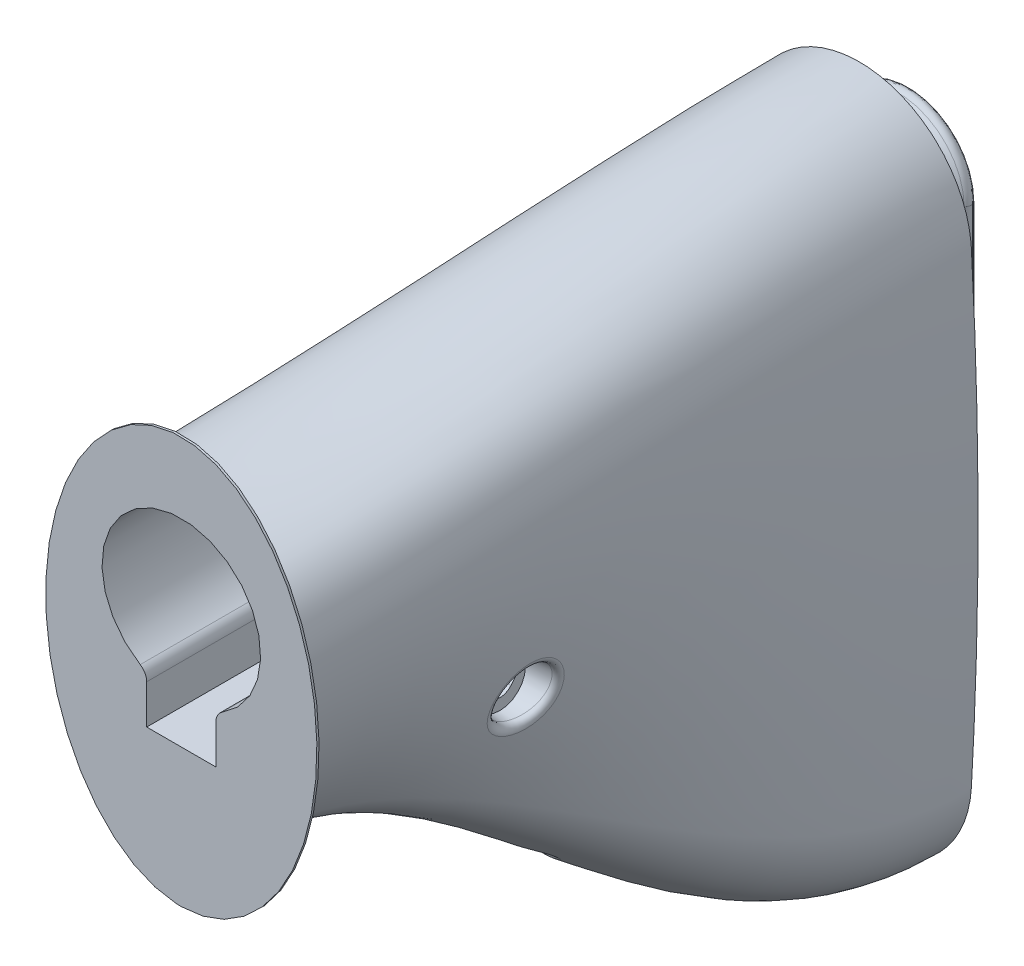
SolidWorks part; units mm, degrees
ref_plane "Front Plane" through (0, 0, 0) normal (0, 0, 1) x (1, 0, 0)
ref_plane "Top Plane" through (0, 0, 0) normal (0, 1, 0) x (1, 0, 0)
ref_plane "Right Plane" through (0, 0, 0) normal (1, 0, 0) x (0, 0, -1)
sketch "Sketch1" plane through (0, 0, 0) normal (0, 0, 1) x (1, 0, 0)
  line L0 (0, 37.2523) -> (0, -28.9777) construction
  line L1 (-22.225, 1.7278) -> (-22.225, 17.909) construction
  arc A0 (-14.2875, 13.501) -> (14.2875, 13.501) centre (0, -21.8186) cw
  arc A1 (-14.2875, 13.501) -> (-22.225, 1.7278) centre (-9.525, 1.7278) ccw
  arc A2 (14.2875, 13.501) -> (22.225, 1.7278) centre (9.525, 1.7278) cw
  arc A3 (-9.9123, -33.3395) -> (9.9123, -33.3395) centre (0, -25.4) ccw
  arc A4 (-22.225, 1.7278) -> (-9.9123, -33.3395) centre (33.8684, 1.7278) ccw
  arc A5 (22.225, 1.7278) -> (9.9123, -33.3395) centre (-33.8684, 1.7278) cw
  dimension "D1" = 12.7
  dimension "D2" = 38.1
  dimension "D3" = 25.4
  dimension "D4" = 44.45
  dimension "D5" = 21.8186
ref_plane "Plane1" through (0, 0, -127) normal (0, 0, -1) x (-1, 0, 0)
sketch "Sketch2" plane through (0, 0, -127) normal (0, 0, -1) x (-1, 0, 0)
  line L0 (0, 200037.2523) -> (0, -200028.9777) construction
  line L1 (0, 25.4) -> (0, -101.6) construction
  line L2 (-22.225, -38.1) -> (22.225, -38.1) construction
  line L3 (-20.9709, 5.5991) -> (-20.9709, -81.7991) construction
  arc A6 (20.9709, 5.5991) -> (14.2875, 19.7925) centre (0, 4.3945) ccw
  arc A7 (20.9709, -81.7991) -> (20.9709, 5.5991) centre (-739.775, -38.1) ccw
  arc A8 (-20.9709, -81.7991) -> (20.9709, -81.7991) centre (0, -80.5945) ccw
  arc A9 (-20.9709, 5.5991) -> (-20.9709, -81.7991) centre (739.775, -38.1) ccw
  arc A10 (-14.2875, 19.7925) -> (-20.9709, 5.5991) centre (0, 4.3945) ccw
  arc A11 (14.2875, 19.7925) -> (-14.2875, 19.7925) centre (0, 4.3945) ccw
  dimension "D1" = 25.4
  dimension "D2" = 762
  dimension "D4" = 127
  dimension "D5" = 44.45
loft "Loft1" add profiles "Sketch1", "Sketch2"
sketch "Sketch3" plane through (0, 0, 0) normal (0, 0, 1) x (1, 0, 0)
  line L0 (-6.477, -13.373) -> (-6.477, -22.225)
  line L1 (-6.477, -22.225) -> (6.477, -22.225)
  line L2 (6.477, -22.225) -> (6.477, -13.373)
  line L3 (0, -22.225) -> (0, 0) construction
  arc A0 (6.477, -13.373) -> (-6.477, -13.373) centre (0, 0) ccw
  point P11 (0, 14.859)
  dimension "D2" = 14.859
  dimension "D3" = 12.954
  dimension "D4" = 37.084
extrude "Cut-Extrude1" cut sketch "Sketch3" against normal blind 91.44
sketch "Sketch4" plane through (0, 0, 0) normal (1, 0, 0) x (0, 0, -1)
  line L1 (91.44, -22.225) -> (0, -22.225) construction
  circle A0 centre (45.72, -22.225) radius 25.4
  dimension "D1" = 50.8
extrude "Cut-Extrude2" cut sketch "Sketch4" against normal mid plane 2.54
sketch "Sketch5" plane through (0, 0, 0) normal (1, 0, 0) x (0, 0, -1)
  line L0 (91.44, -22.225) -> (0, -22.225) construction
  line L1 (47.763, -25.7177) -> (48.895, -27.0667)
  line L2 (48.895, -27.0667) -> (48.895, -27.7973)
  line L3 (48.895, -27.7973) -> (47.763, -29.1463)
  line L4 (45.72, -27.432) -> (48.895, -27.432) construction
  arc A0 (47.763, -25.7177) -> (47.763, -29.1463) centre (45.72, -27.432) ccw
  circle A1 centre (45.72, -27.432) radius 2.667 construction
  circle A2 centre (45.72, -22.225) radius 25.4
  circle A3 centre (45.72, -22.225) radius 25.4 construction
  point P2 (45.72, -24.765)
  point P13 (48.387, -27.432)
  dimension "D1" = 5.334
  dimension "D4" = 0.508
  dimension "D2" = 2.54
  dimension "D5" = 100
  dimension "D3" = 0
extrude "Cut-Extrude3" cut sketch "Sketch5" against normal through all both and the other way through all
ref_plane "Plane2" through (13.97, 0, 0) normal (1, 0, 0) x (0, 0, -1)
ref_plane "Plane3" through (-13.97, 0, 0) normal (-1, 0, 0) x (0, 0, 1)
sketch "Sketch6" plane through (13.97, 0, 0) normal (1, 0, 0) x (0, 0, -1)
  circle A0 centre (45.72, -27.432) radius 4.7625
  dimension "D1" = 9.525
extrude "Cut-Extrude4" cut sketch "Sketch6" along normal through all draft 5
sketch "Sketch7" plane through (-13.97, 0, 0) normal (-1, 0, 0) x (0, 0, 1)
  line L1 (-51.2926, -27.432) -> (-48.5063, -32.258)
  line L2 (-48.5063, -32.258) -> (-42.9337, -32.258)
  line L3 (-42.9337, -32.258) -> (-40.1474, -27.432)
  line L4 (-40.1474, -27.432) -> (-42.9337, -22.606)
  line L5 (-42.9337, -22.606) -> (-48.5063, -22.606)
  line L6 (-48.5063, -22.606) -> (-51.2926, -27.432)
  circle A0 centre (-45.72, -27.432) radius 4.826 construction
  dimension "D1" = 9.652
extrude "Cut-Extrude5" cut sketch "Sketch7" along normal through all draft 5
sketch "Sketch8" plane through (0, 0, 0) normal (1, 0, 0) x (0, 0, -1)
  line L0 (91.44, 14.859) -> (0, 14.859)
  line L1 (91.44, 14.859) -> (0, 14.859) construction
  line L2 (0, 0) -> (91.44, 0) construction
  line L3 (91.44, 14.859) -> (106.299, 0)
  line L4 (106.299, 0) -> (91.44, 0)
  line L5 (91.44, 14.859) -> (91.44, 0)
  dimension "D1" = 45
revolve "Cut-Revolve1" cut sketch "Sketch8" angle 360 about L2
sketch "Sketch9" plane through (0, -22.225, 0) normal (0, 1, 0) x (1, 0, 0)
  line L0 (-6.477, 91.44) -> (6.477, 91.44)
  line L1 (6.477, 91.44) -> (0, 97.917)
  line L2 (0, 97.917) -> (-6.477, 91.44)
  dimension "D1" = 90
extrude "Cut-Extrude6" cut sketch "Sketch9" along normal up to next
fillet "Fillet1" radius 1.27 7 edges at (18.7831, -26.1096, -40.7079)
fillet "Fillet2" radius 1.27 2 edges at (1.27, -47.625, -45.72) (-1.27, -47.625, -45.72)
fillet "Fillet3" radius 1.27 6 edges at (0.898, -22.225, -70.748) (0.898, -22.225, -20.692) (-0.898, -22.225, -70.748) (-0.898, -22.225, -20.692) (-1.27, -22.225, -45.72) (1.27, -22.225, -45.72)
fillet "Fillet4" radius 2.54 3 edges at (6.477, -17.799, -91.44) (0, 14.859, -91.44) (-6.477, -17.799, -91.44)
fillet "Fillet5" radius 2.54 6 edges at (-6.477, -13.373, -45.1939) (-6.1935, -13.1942, -91.554) (6.1935, -13.1942, -91.554) (6.477, -13.373, -45.1939)
sketch "Sketch10" plane through (0, 0, -127) normal (0, 0, -1) x (-1, 0, 0)
  line L0 (0, 4.3945) -> (0, -80.5945) construction
  line L1 (12.7, 4.3945) -> (12.7, -80.5945)
  line L2 (-12.7, 4.3945) -> (-12.7, -80.5945)
  arc A0 (12.7, 4.3945) -> (-12.7, 4.3945) centre (0, 4.3945) ccw
  arc A1 (-12.7, -80.5945) -> (12.7, -80.5945) centre (0, -80.5945) ccw
  arc A4 (14.2875, 19.7925) -> (-14.2875, 19.7925) centre (0, 4.3945) ccw construction
  arc A5 (-20.9709, -81.7991) -> (20.9709, -81.7991) centre (0, -80.5945) ccw construction
  point P3 (0, -38.1)
  dimension "D1" = 25.4
extrude "Boss-Extrude1" add sketch "Sketch10" along normal blind 12.7
ref_plane "Plane4" through (0, -80.5945, 0) normal (0, -1, 0) x (-1, 0, 0)
sketch "Sketch11" plane through (0, -80.5945, 0) normal (0, -1, 0) x (-1, 0, 0)
  line L0 (-12.7, 139.7) -> (-12.7, 127) construction
  line L1 (-10.4549, 132.4201) -> (-12.328, 134.2932)
  line L2 (20.9709, 127) -> (-20.9709, 127) construction
  line L4 (-11.43, 136.4612) -> (0, 136.4612)
  line L5 (0, 136.4612) -> (0, 139.7)
  line L6 (0, 139.7) -> (-19.05, 139.7)
  line L7 (-19.05, 139.7) -> (-19.05, 127)
  line L8 (-19.05, 127) -> (-12.7, 127)
  line L9 (12.7, 139.7) -> (-12.7, 139.7) construction
  line L10 (-9.9504, 128.5875) -> (-10.8669, 127)
  line L11 (-12.7, 127) -> (-10.8669, 127)
  line L12 (12.7, 127) -> (-12.7, 127) construction
  arc A0 (-10.4549, 132.4201) -> (-9.9504, 128.5875) centre (-12.7, 130.175) cw
  arc A1 (-12.328, 134.2932) -> (-11.43, 136.4612) centre (-11.43, 135.1912) cw
  point P9 (-12.7, 133.35)
  dimension "D1" = 45
  dimension "D2" = 1.27
  dimension "D3" = 6.35
  dimension "D4" = 60
sketch "Sketch12" plane through (0, 0, -127) normal (0, 0, -1) x (-1, 0, 0)
  line L2 (12.7, -80.5945) -> (12.7, 4.3945)
  line L3 (-12.7, 4.3945) -> (-12.7, -80.5945)
  line L4 (12.7, -80.5945) -> (12.7, 4.3945)
  line L5 (-12.7, 4.3945) -> (-12.7, -80.5945)
  arc A2 (-12.7, -80.5945) -> (12.7, -80.5945) centre (0, -80.5945) ccw
  arc A3 (12.7, 4.3945) -> (-12.7, 4.3945) centre (0, 4.3945) ccw
  arc A4 (-12.7, -80.5945) -> (12.7, -80.5945) centre (0, -80.5945) ccw
  arc A5 (12.7, 4.3945) -> (-12.7, 4.3945) centre (0, 4.3945) ccw
  dimension "D1" = 0
sweep "Cut-Sweep1" cut profiles "Sketch11" path "Sketch12"
sketch "Sketch15" plane through (0, 0, -136.4612) normal (0, 0, -1) x (-1, 0, 0)
  line L0 (0, 4.3945) -> (0, -80.5945) construction
  line L1 (4.7625, 4.3945) -> (4.7625, -80.5945)
  line L2 (-4.7625, 4.3945) -> (-4.7625, -80.5945)
  arc A0 (4.7625, 4.3945) -> (-4.7625, 4.3945) centre (0, 4.3945) ccw
  arc A1 (-4.7625, -80.5945) -> (4.7625, -80.5945) centre (0, -80.5945) ccw
  arc A3 (11.43, 4.3945) -> (-11.43, 4.3945) centre (0, 4.3945) ccw construction
  arc A4 (-11.43, -80.5945) -> (11.43, -80.5945) centre (0, -80.5945) ccw construction
  point P3 (0, -38.1)
  dimension "D1" = 9.525
extrude "Cut-Extrude8" cut sketch "Sketch15" against normal blind 3.175
sketch "Sketch16" plane through (0, 0, 0) normal (1, 0, 0) x (0, 0, -1)
  line L0 (136.4612, -38.1) -> (127, -38.1)
  line L1 (136.4612, -80.5945) -> (136.4612, 4.3945) construction
  line L2 (85.0868, -87.0515) -> (40.1064, -51.2095) construction
  line L3 (62.5966, -69.1305) -> (91.4328, -32.9422) construction
  line L4 (127, -81.7991) -> (127, 5.5991) construction
  arc A0 (127, -38.1) -> (62.5966, -69.1305) centre (127, -120.4495) ccw
  spline S0 degree 3 poles (0, -38.1001) (0.2528, -38.1011) (0.7399, -38.1031) (1.4431, -38.1184) (2.0914, -38.1401) (2.6853, -38.1671) (3.7848, -38.2288) (5.0544, -38.3324) (6.2386, -38.4652) (6.8036, -38.5359) (7.7157, -38.6551) (9.2407, -38.8892) (11.3636, -39.2987) (13.4687, -39.7862) (16.2533, -40.5365) (19.6965, -41.6566) (23.7593, -43.2637) (27.7633, -45.1118) (31.7142, -47.1771) (35.6179, -49.4364) (39.4802, -51.8665) (43.3067, -54.444) (47.1032, -57.1459) (50.8753, -59.949) (54.6286, -62.8301) (58.3193, -65.7274) (62.6526, -69.1722) (67.0011, -72.6456) (71.413, -76.1238) (75.1849, -79.0381) (78.9517, -81.8629) (82.7416, -84.5923) (86.5601, -87.2031) (90.4129, -89.6722) (94.3057, -91.9763) (98.2443, -94.0924) (102.2344, -95.9969) (106.282, -97.6665) (110.3928, -99.0776) (113.8773, -100.0186) (116.6953, -100.6169) (118.8293, -100.9868) (120.959, -101.271) (122.6965, -101.434) (124.1485, -101.5279) (125.4544, -101.5872) (126.4447, -101.596) (127, -101.6009) knots 0 0 0 0 0.005235 0.010089 0.014566 0.018669 0.022401 0.037373 0.045045 0.047081 0.049165 0.064095 0.079027 0.093932 0.108838 0.138743 0.168862 0.199275 0.230033 0.261162 0.292663 0.324521 0.356702 0.389162 0.421847 0.454695 0.486338 0.536495 0.569959 0.602691 0.635213 0.667468 0.69941 0.731003 0.762225 0.793075 0.82357 0.853756 0.883706 0.913524 0.928441 0.943358 0.958368 0.97293 0.979491 0.988501 1 1 1 1 construction
  spline S1 degree 3 poles (-430.4883, -940.6885) (233.836, 1058.9492) (-106.8359, -1198.645) (557.4846, 800.9767) knots -1.531202 -1.531202 -1.531202 -1.531202 2.531195 2.531195 2.531195 2.531195 only from (0, -38.1) to (127, -101.6005)
  spline S2 degree 3 poles (662.9124, -834.4695) (235.6818, 943.1779) (-83.278, -901.4893) (-510.5078, 876.132) knots -3.175495 -3.175495 -3.175495 -3.175495 4.175469 4.175469 4.175469 4.175469 only from (152.4, 25.4003) to (0, 16.2814)
  spline S4 degree 3 poles (0, -38.1) (47.3302, -38.0999) (79.6698, -101.6006) (127, -101.6005) knots 0 0 0 0 1 1 1 1 construction
sketch "Sketch17" plane through (0, 0, -133.2862) normal (0, 0, -1) x (-1, 0, 0)
  line L0 (0, -38.1) -> (0, -69.1305) construction
  circle A0 centre (0, -38.1) radius 4.7625
  dimension "D1" = 9.525
sweep "Cut-Sweep2" cut profiles "Sketch17" path "Sketch16"
sketch "Sketch18" plane through (0, 0, 0) normal (1, 0, 0) x (0, 0, -1)
  line L0 (106.299, 0) -> (139.8698, 0) construction
  line L1 (110.3615, -39.7984) -> (159.0533, -29.7532) construction
  arc A0 (106.299, 0) -> (110.3615, -39.7984) centre (106.299, -20.1065) cw
  arc A1 (127, -38.1) -> (62.5966, -69.1305) centre (127, -120.4495) ccw construction
ref_plane "Plane5" through (0, 0, -106.299) normal (0, 0, 1) x (1, 0, 0)
sketch "Sketch19" plane through (0, 0, -106.299) normal (0, 0, 1) x (1, 0, 0)
  circle A0 centre (0, 0) radius 4.7625
  dimension "D1" = 9.525
sweep "Cut-Sweep3" cut profiles "Sketch19" path "Sketch18"
fillet "Fillet7" radius 1.27 2 edges at (4.7169, -69.1014, -63.4638) (-4.6765, -1.119, -101.4905)
fillet "Fillet8" radius 1.27 12 edges at (0, -85.357, -136.4612) (4.7625, -38.1, -136.4612) (0, 9.157, -136.4612) (0, -33.3375, -133.2862) (0, -42.8625, -133.2862) (-4.7625, -59.3472, -133.2862) (0, -85.357, -133.2862) (4.7625, -59.3472, -133.2862) (4.7625, -16.8528, -133.2862) (0, 9.157, -133.2862) (-4.7625, -38.1, -136.4612) (-4.7625, -16.8528, -133.2862)
sketch "Sketch13" plane through (0, 0, 0) normal (0, 0, 1) x (1, 0, 0)
  line L4 (-6.477, -13.373) -> (-6.477, -22.225)
  line L5 (-6.477, -22.225) -> (6.477, -22.225)
  line L6 (6.477, -22.225) -> (6.477, -13.373)
  line L7 (-6.477, -14.8802) -> (-6.477, -22.225)
  line L8 (-6.477, -22.225) -> (6.477, -22.225)
  line L9 (6.477, -22.225) -> (6.477, -14.8802)
  arc A0 (6.477, -14.8802) -> (7.7006, -12.7079) centre (9.017, -14.8802) cw
  arc A1 (6.477, -13.373) -> (-6.477, -13.373) centre (0, 0) ccw
  arc A2 (7.7006, -12.7079) -> (-7.7006, -12.7079) centre (0, 0) ccw
  arc A3 (-6.477, -14.8802) -> (-7.7006, -12.7079) centre (-9.017, -14.8802) ccw
  ellipse E0 centre (0, -10.0183) end of major axis (0, -48.1183) minor radius 25.4
  dimension "D2" = 2.54
  dimension "D3" = 76.2
  dimension "D4" = 50.8
  dimension "D1" = 0
extrude "Boss-Extrude2" add sketch "Sketch13" against normal blind 0.4064
sketch "Sketch22" plane through (0, 0, -133.2862) normal (0, 0, -1) x (-1, 0, 0)
  line L0 (-1.6477, 1.1014) -> (-1.6477, -83.7739) construction
  text T0 "HOFFMAN             TACTICAL" font "Arial Rounded MT Bold" height 3.175
extrude "Cut-Extrude9" cut sketch "Sketch22" against normal blind 0.4064
